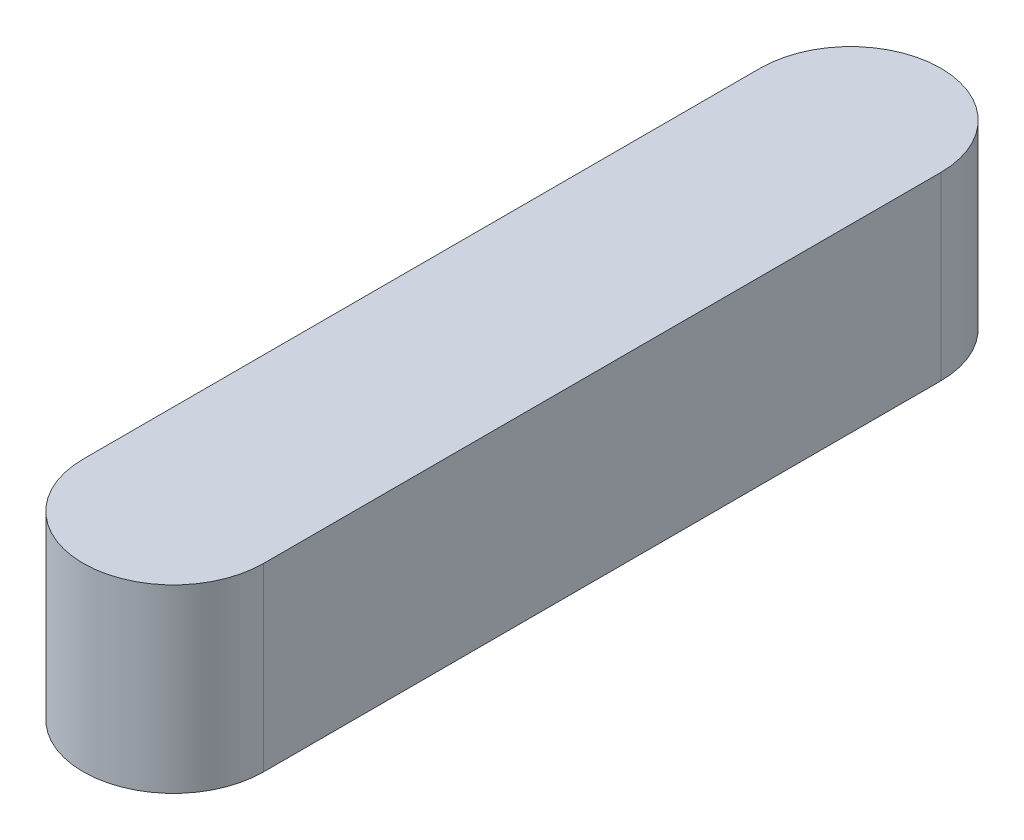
SolidWorks part; units mm, degrees
ref_plane "Front Plane" through (0, 0, 0) normal (0, 0, 1) x (1, 0, 0)
ref_plane "Top Plane" through (0, 0, 0) normal (0, 1, 0) x (1, 0, 0)
ref_plane "Right Plane" through (0, 0, 0) normal (1, 0, 0) x (0, 0, -1)
sketch "Sketch2" plane through (0, 0, 0) normal (0, 0, 1) x (1, 0, 0)
  line L1 (0, 0) -> (4, 0)
  line L2 (0, 0) -> (0, 4)
  line L3 (0, 4) -> (4, 4)
  line L4 (4, 0) -> (4, 4)
  dimension "D1" = 4
  dimension "D2" = 4
extrude "Boss-Extrude1" add sketch "Sketch2" along normal blind 15
sketch "Sketch3" plane through (0, 4, 0) normal (0, 1, 0) x (1, 0, 0)
  line L0 (0, 0) -> (4, 0)
  line L5 (0, -15) -> (4, -15)
  arc A0 (0, 0) -> (4, 0) centre (2, 0) cw
  arc A1 (0, -15) -> (4, -15) centre (2, -15) ccw
extrude "Boss-Extrude2" add sketch "Sketch3" against normal blind 4
